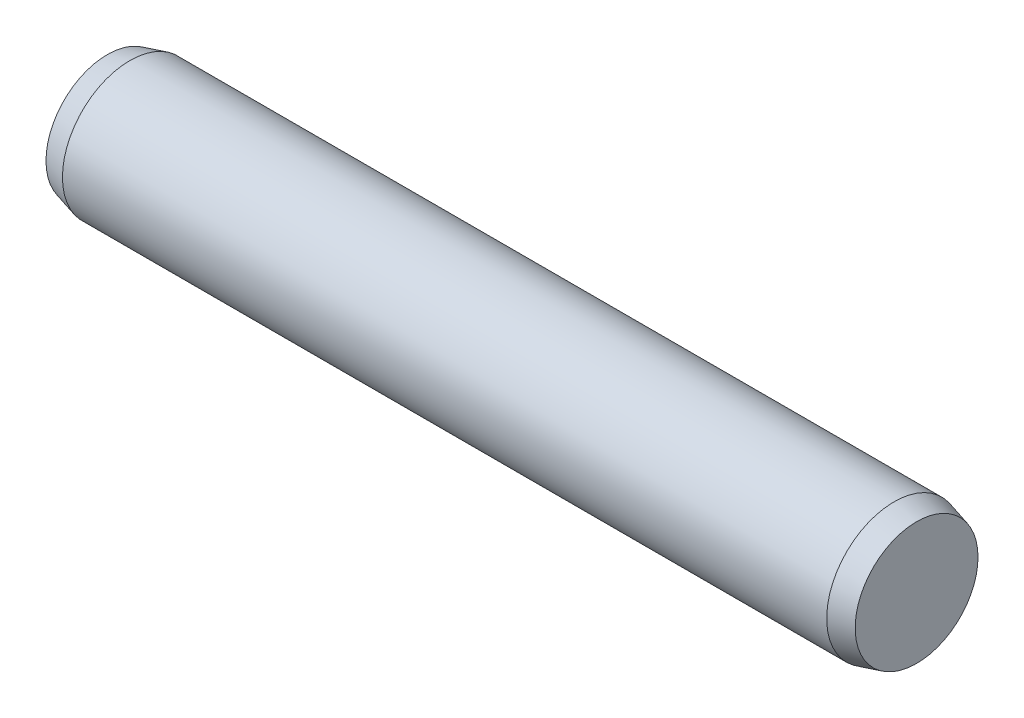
SolidWorks part; units mm, degrees
ref_plane "Front Plane" through (0, 0, 0) normal (0, 0, 1) x (1, 0, 0)
ref_plane "Top Plane" through (0, 0, 0) normal (0, 1, 0) x (1, 0, 0)
ref_plane "Right Plane" through (0, 0, 0) normal (1, 0, 0) x (0, 0, -1)
sketch "Sketch1" plane through (0, 0, 0) normal (0, 0, 1) x (1, 0, 0)
  line L0 (-8.5, 0) -> (8.5, 0) construction
  line L1 (8.5, 1.5) -> (8.5, -1.5) construction
  line L2 (-8.5, 1.5) -> (-8.5, -1.5) construction
  line L3 (9, 1.5) -> (9, -1.5) construction
  line L4 (-9, 1.5) -> (-9, -1.5) construction
  line L5 (-8.5, 0) -> (-9, 0) construction
  line L6 (8.5, 0) -> (9, 0) construction
sketch "Sketch2" plane through (0, 0, 0) normal (1, 0, 0) x (0, 0, -1)
  circle A0 centre (0, 0) radius 1.5
extrude "Extrude1" add sketch "Sketch2" against normal up to vertex (8.5 mm away) and the other way up to vertex (8.5 mm away)
sketch "Sketch3" plane through (8.5, 0, 0) normal (1, 0, 0) x (0, 0, -1)
  circle A1 centre (0, 0) radius 1.5
  circle A2 centre (0, 0) radius 1.5
  dimension "D1" = 0
extrude "Extrude2" add sketch "Sketch3" along normal up to vertex (0.5 mm away) draft 15
sketch "Sketch4" plane through (-8.5, 0, 0) normal (-1, 0, 0) x (0, 0, 1)
  circle A1 centre (0, 0) radius 1.5
  circle A2 centre (0, 0) radius 1.5
  dimension "D1" = 0
extrude "Extrude3" add sketch "Sketch4" along normal up to vertex (0.5 mm away) draft 15
equation "\"D1@Sketch1\" = \"C@Sketch1\""
